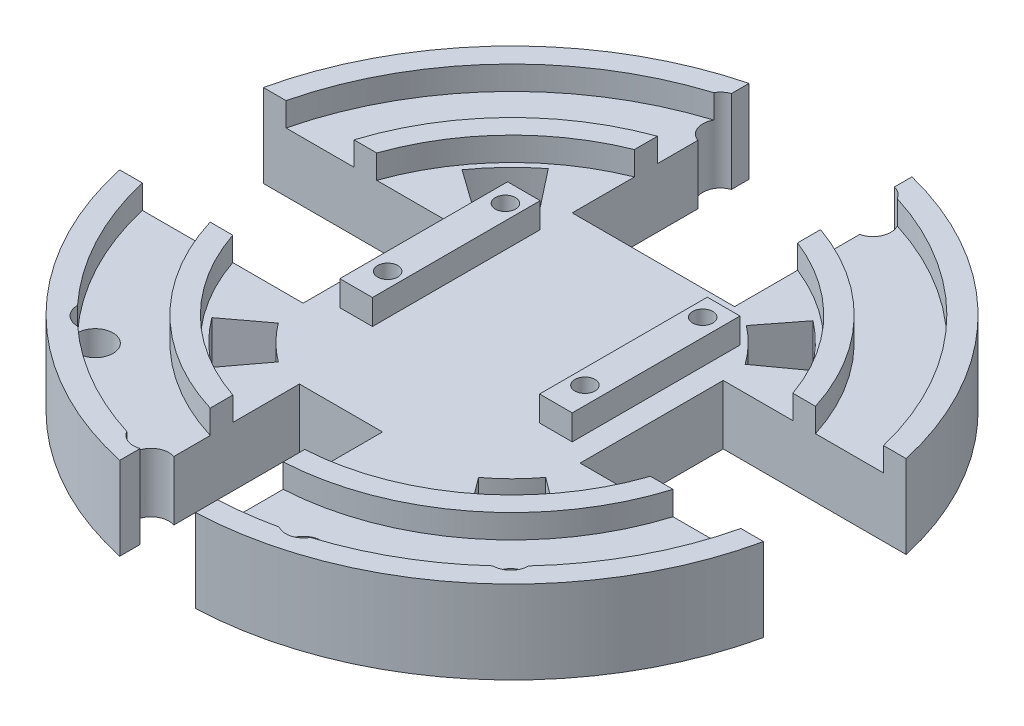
SolidWorks part; units mm, degrees
ref_plane "Front Plane" through (0, 0, 0) normal (0, 0, 1) x (1, 0, 0)
ref_plane "Top Plane" through (0, 0, 0) normal (0, 1, 0) x (1, 0, 0)
ref_plane "Right Plane" through (0, 0, 0) normal (1, 0, 0) x (0, 0, -1)
sketch "Sketch1" plane through (0, 0, 0) normal (0, 1, 0) x (1, 0, 0)
  line L0 (16.1798, 0) -> (16.1798, -20.0078)
  line L1 (0, 0) -> (29.6291, 0) construction
  line L2 (0, 0) -> (0, 5.0439) construction
  line L3 (0, 30.4419) -> (29.6291, 30.4419) construction
  line L4 (29.6291, 0) -> (29.6291, 5.0439) construction
  line L5 (8.5598, -0.1778) -> (8.5598, 0) construction
  line L6 (29.8069, 7.9375) -> (29.6291, 7.9375) construction
  line L7 (22.1297, 30.6197) -> (22.1297, 30.4419) construction
  line L8 (29.6291, 22.9997) -> (31.1531, 22.9997)
  line L9 (31.1531, 22.9997) -> (29.6291, 25.6393) construction
  line L10 (29.6291, 7.6835) -> (31.1531, 7.6835)
  line L11 (31.1531, 7.6835) -> (29.6291, 5.0439) construction
  line L12 (0, 5.0439) -> (-1.524, 7.6835) construction
  line L13 (-1.524, 7.6835) -> (0, 7.6835)
  line L14 (0, 22.9997) -> (-1.524, 22.9997)
  line L15 (-1.524, 22.9997) -> (0, 25.6393) construction
  line L16 (0, 25.6393) -> (0, 30.4419) construction
  line L17 (0, 7.6835) -> (0, 22.9997)
  line L18 (29.6291, 7.6835) -> (29.6291, 22.9997)
  line L19 (29.6291, 25.6393) -> (29.6291, 30.4419) construction
  line L20 (0, 22.9997) -> (0, 25.6393) construction
  line L21 (0, 5.0439) -> (0, 7.6835) construction
  line L22 (29.6291, 5.0439) -> (29.6291, 7.6835) construction
  line L23 (29.6291, 22.9997) -> (29.6291, 25.6393) construction
  line L24 (-1.524, 7.6835) -> (-1.524, 7.9375) construction
  line L25 (-1.524, 7.9375) -> (-0.1778, 7.9375) construction
  line L26 (31.1531, 7.6835) -> (31.1531, 7.9375) construction
  line L27 (29.8069, 7.9375) -> (31.1531, 7.9375) construction
  line L28 (31.1531, 22.9997) -> (31.1531, 22.7457) construction
  line L29 (31.1531, 22.7457) -> (29.8069, 22.7457) construction
  line L30 (-1.524, 22.7457) -> (-1.524, 22.9997) construction
  line L31 (-0.1778, 22.7457) -> (-1.524, 22.7457) construction
  line L32 (7.2898, 0) -> (7.2898, -19.2219)
  line L33 (-1.524, 7.6835) -> (-19.6255, 7.6835)
  line L34 (7.2898, 0) -> (16.1798, 0)
  line L35 (31.1531, 7.6835) -> (49.2546, 7.6835)
  line L36 (-1.524, 22.9997) -> (-19.5718, 22.9997)
  line L37 (6.0261, 30.4419) -> (6.0261, 49.3632)
  line L38 (23.3997, 30.4419) -> (23.3997, 49.4149)
  line L39 (31.1531, 22.9997) -> (49.2009, 22.9997)
  line L40 (6.0261, 30.4419) -> (23.3997, 30.4419)
  line L41 (6.0261, 31.8897) -> (7.2961, 31.8897) construction
  line L42 (22.1297, 31.8897) -> (23.3997, 31.8897) construction
  line L43 (8.5598, -1.4478) -> (7.2898, -1.4478) construction
  line L44 (8.5598, -0.1778) -> (8.5598, -1.4478) construction
  line L45 (8.5598, -1.4478) -> (14.9098, -1.4478) construction
  line L46 (14.9098, -1.4478) -> (16.1798, -1.4478) construction
  arc A0 (7.2898, -19.2219) -> (-19.6255, 7.6835) centre (14.8145, 15.2209) cw
  circle A1 centre (14.8145, 15.2209) radius 32.7152 construction
  circle A2 centre (14.8145, 15.2209) radius 32.7152 construction
  arc A3 (16.1798, -20.0078) -> (49.2546, 7.6835) centre (14.8145, 15.2209) ccw
  arc A4 (-19.5718, 22.9997) -> (6.0261, 49.3632) centre (14.8145, 15.2209) cw
  arc A5 (23.3997, 49.4149) -> (49.2009, 22.9997) centre (14.8145, 15.2209) cw
  point P73 (7.0142, 33.4093)
  point P74 (3.2844, 30.4419)
  point P75 (4.7389, 34.7287)
  point P76 (3.1281, 31.8897)
  point P77 (4.3917, 31.8897)
  point P78 (5.3912, 32.0959)
  point P79 (-17.0497, 7.6835)
  point P80 (7.2898, -23.7407)
  dimension "D4" = 2.54
  dimension "D1" = 60
  dimension "D2" = 0.254
  dimension "D3" = 1.27
extrude "Boss-Extrude1" add sketch "Sketch1" along normal up to surface (6.35 mm away)
sketch "Sketch2" plane through (0, 6.35, 0) normal (0, 1, 0) x (1, 0, 0)
  line L0 (5.0102, 9.0488) -> (24.6189, 9.0488) construction
  line L1 (5.0102, 9.0488) -> (24.6189, 9.0488) construction
  line L2 (27.2478, 9.2266) -> (23.7553, 9.2266)
  line L3 (41.2085, -50.0815) -> (43.3675, -50.0815) construction
  line L4 (2.3812, 27.1717) -> (2.3812, 3.2703)
  line L5 (2.3812, 3.2703) -> (27.2478, 3.2703)
  line L6 (27.2478, 3.2703) -> (27.2478, 27.1717)
  line L7 (27.2478, 27.1717) -> (2.3812, 27.1717)
  line L8 (2.3812, 27.1717) -> (2.3812, 9.2266)
  line L9 (6.0515, 13.7859) -> (6.0515, 25.4699) construction
  line L10 (27.2478, 9.2266) -> (27.2478, 27.1717)
  line L11 (27.2478, 27.1717) -> (23.7553, 27.1717)
  line L12 (14.8146, 27.1717) -> (14.8146, 9.0488) construction
  line L13 (6.0515, 13.7859) -> (6.0515, 25.4699) construction
  line L14 (5.8737, 9.2266) -> (5.8737, 27.1717)
  line L15 (23.7553, 9.2266) -> (23.7553, 27.1717)
  line L16 (5.8737, 9.2266) -> (2.3812, 9.2266)
  line L17 (5.8737, 27.1717) -> (2.3812, 27.1717)
  line L18 (5.8737, 27.1717) -> (23.7553, 27.1717) construction
  line L19 (41.2085, -50.0815) -> (43.3675, -50.0815) construction
  line L20 (3.1814, 25.0634) -> (5.3403, 25.0634) construction
  circle A0 centre (4.2608, 25.0634) radius 1.0922 construction
  circle A1 centre (4.2608, 25.0634) radius 1.0922 construction
  circle A2 centre (4.2608, 12.465) radius 1.0922 construction
  circle A3 centre (25.3682, 12.465) radius 1.0922 construction
  circle A4 centre (25.3682, 25.0634) radius 1.0922 construction
  circle A5 centre (4.2608, 25.0634) radius 1.0922 construction
  circle A6 centre (4.2608, 12.465) radius 1.0922 construction
  circle A7 centre (25.3682, 12.465) radius 1.0922 construction
  circle A8 centre (25.3682, 25.0634) radius 1.0922 construction
  circle A9 centre (4.2608, 25.0634) radius 1.0795
  circle A10 centre (25.3682, 25.0634) radius 1.0795
  circle A11 centre (25.3682, 12.465) radius 1.0795
  circle A12 centre (4.2608, 12.465) radius 1.0795
  point P17 (5.353, 25.0634)
  dimension "D2" = 0.1778
  dimension "D3" = 0.1778
  dimension "D1" = 0
extrude "Boss-Extrude2" add sketch "Sketch2" along normal up to surface (2.6924 mm away)
sketch "Sketch3" plane through (0, 6.35, 0) normal (0, 1, 0) x (1, 0, 0)
  circle A0 centre (25.3682, 25.0634) radius 1.0795 construction
  circle A1 centre (25.3682, 12.465) radius 1.0922 construction
  circle A2 centre (4.2608, 12.465) radius 1.0922 construction
  circle A3 centre (4.2608, 25.0634) radius 1.0795 construction
  circle A4 centre (25.3682, 25.0634) radius 1.0795
  circle A5 centre (25.3682, 12.465) radius 1.0922
  circle A6 centre (4.2608, 12.465) radius 1.0922
  circle A7 centre (4.2608, 25.0634) radius 1.0795
extrude "Cut-Extrude1" cut sketch "Sketch3" against normal through all
sketch "Sketch5" plane through (0, 6.35, 0) normal (0, 1, 0) x (1, 0, 0)
  line L0 (-19.5718, 22.9997) -> (-17.1454, 22.9997)
  line L1 (-19.5718, 22.9997) -> (0, 22.9997) construction
  line L2 (6.0261, 30.4419) -> (6.0261, 49.3632) construction
  line L3 (6.0261, 46.9182) -> (6.0261, 49.3632)
  line L4 (6.0261, 37.1017) -> (6.0261, 39.5658)
  line L5 (-7.4451, 22.9997) -> (-9.8715, 22.9997)
  line L6 (0, 7.6835) -> (-19.6255, 7.6835) construction
  line L7 (7.2898, -19.2219) -> (7.2898, 0) construction
  line L8 (16.1798, 0) -> (16.1798, -20.0078) construction
  line L9 (49.2546, 7.6835) -> (29.6291, 7.6835) construction
  line L10 (29.6291, 22.9997) -> (49.2009, 22.9997) construction
  line L11 (23.3997, 49.4149) -> (23.3997, 30.4419) construction
  line L12 (23.3997, 39.6382) -> (23.3997, 37.1822)
  line L13 (37.0742, 22.9997) -> (39.5006, 22.9997)
  line L14 (39.5753, 7.6835) -> (37.1571, 7.6835)
  line L15 (16.1798, -10.6256) -> (16.1798, -8.3192)
  line L16 (7.2898, -9.5437) -> (7.2898, -7.1259)
  line L17 (-7.528, 7.6835) -> (-9.9462, 7.6835)
  line L18 (-19.6255, 7.6835) -> (-17.2032, 7.6835)
  line L19 (7.2898, -16.7998) -> (7.2898, -19.2219)
  line L20 (16.1798, -20.0078) -> (16.1798, -17.6437)
  line L21 (46.8323, 7.6835) -> (49.2546, 7.6835)
  line L22 (46.7745, 22.9997) -> (49.2009, 22.9997)
  line L23 (23.3997, 46.9738) -> (23.3997, 49.4149)
  arc A0 (49.2009, 22.9997) -> (23.3997, 49.4149) centre (14.8145, 15.2209) ccw construction
  arc A1 (16.1798, -20.0078) -> (49.2546, 7.6835) centre (14.8145, 15.2209) ccw construction
  arc A2 (-19.6255, 7.6835) -> (7.2898, -19.2219) centre (14.8145, 15.2209) ccw construction
  arc A3 (6.0261, 49.3632) -> (-19.5718, 22.9997) centre (14.8145, 15.2209) ccw construction
  arc A4 (49.2009, 22.9997) -> (23.3997, 49.4149) centre (14.8145, 15.2209) ccw
  arc A5 (16.1798, -20.0078) -> (49.2546, 7.6835) centre (14.8145, 15.2209) ccw
  arc A6 (-19.6255, 7.6835) -> (7.2898, -19.2219) centre (14.8145, 15.2209) ccw
  arc A7 (6.0261, 49.3632) -> (-19.5718, 22.9997) centre (14.8145, 15.2209) ccw
  arc A8 (-17.1454, 22.9997) -> (6.0261, 46.9182) centre (14.8145, 15.2209) cw
  circle A9 centre (14.8145, 15.2209) radius 32.7152 construction
  arc A10 (-9.8715, 22.9997) -> (6.0261, 39.5658) centre (14.8145, 15.2209) cw
  arc A11 (6.0261, 37.1017) -> (-7.4451, 22.9997) centre (14.8146, 15.2209) ccw
  circle A12 centre (14.8145, 15.2209) radius 26.0604 construction
  arc A13 (-17.2032, 7.6835) -> (7.2898, -16.7998) centre (14.8145, 15.2209) ccw
  arc A14 (16.1798, -17.6437) -> (46.8323, 7.6835) centre (14.8145, 15.2209) ccw
  arc A15 (46.7745, 22.9997) -> (23.3997, 46.9738) centre (14.8145, 15.2209) ccw
  arc A16 (16.1798, -10.6256) -> (39.5753, 7.6835) centre (14.8145, 15.2209) ccw
  arc A17 (23.3997, 37.1822) -> (37.0742, 22.9997) centre (14.8145, 15.2209) cw
  arc A18 (39.5006, 22.9997) -> (23.3997, 39.6382) centre (14.8145, 15.2209) ccw
  arc A19 (16.1798, -8.3192) -> (37.1571, 7.6835) centre (14.8145, 15.2209) ccw
  arc A20 (7.2898, -9.5437) -> (-9.9462, 7.6835) centre (14.8145, 15.2209) cw
  arc A21 (-7.528, 7.6835) -> (7.2898, -7.1259) centre (14.8145, 15.2209) ccw
  dimension "D1" = 0.1778
  dimension "D2" = 0.1778
extrude "Boss-Extrude3" add sketch "Sketch5" along normal blind 2.54
sketch "Sketch6" plane through (0, 6.35, 0) normal (0, 1, 0) x (1, 0, 0)
  line L0 (-3.8614, 28.5501) -> (0.2735, 25.599)
  line L1 (0.6454, 33.268) -> (3.7825, 29.2723)
  line L2 (28.8999, 33.3334) -> (25.7814, 29.3233)
  line L3 (29.3074, 25.6663) -> (33.4286, 28.6365)
  line L4 (29.1176, 4.5172) -> (33.1848, 1.4734)
  line L5 (28.5725, -3.1414) -> (25.5265, 0.924)
  line L6 (4.1108, 0.9179) -> (1.067, -3.1493)
  line L7 (0.5176, 4.509) -> (-3.5478, 1.463)
  line L8 (14.8146, 15.2209) -> (31.7892, 31.5875) construction
  line L9 (14.8146, 15.2209) -> (-1.8541, -1.4572) construction
  line L10 (14.8146, 15.2209) -> (31.5556, -1.5106) construction
  line L12 (14.8146, 15.2209) -> (-2.2357, 31.5087) construction
  arc A0 (-3.8614, 28.5501) -> (0.6454, 33.268) centre (14.8146, 15.2209) cw
  arc A1 (0.2735, 25.599) -> (3.7825, 29.2723) centre (14.8146, 15.2209) cw
  arc A2 (0.5176, 4.509) -> (4.1108, 0.9179) centre (14.8146, 15.2209) ccw
  arc A3 (-3.5478, 1.463) -> (1.067, -3.1493) centre (14.8146, 15.2209) ccw
  arc A4 (6.0261, 37.1017) -> (-7.4451, 22.9997) centre (14.8146, 15.2209) ccw construction
  arc A5 (28.5725, -3.1414) -> (33.1848, 1.4734) centre (14.8146, 15.2209) ccw
  arc A6 (25.5265, 0.924) -> (29.1176, 4.5172) centre (14.8146, 15.2209) ccw
  arc A7 (29.3074, 25.6663) -> (25.7814, 29.3233) centre (14.8146, 15.2209) ccw
  arc A8 (28.8999, 33.3334) -> (33.4286, 28.6365) centre (14.8146, 15.2209) cw
  arc A9 (37.0742, 22.9997) -> (23.3997, 37.1822) centre (14.8145, 15.2209) ccw construction
  arc A10 (-7.528, 7.6835) -> (7.2898, -7.1259) centre (14.8145, 15.2209) ccw construction
  arc A11 (-7.528, 7.6835) -> (7.2898, -7.1259) centre (14.8145, 15.2209) ccw construction
  point P26 (31.332, 31.1468)
  point P29 (27.4504, 2.5923)
  point P30 (-2.2357, 31.5087)
  point P31 (-1.7766, 31.07)
  point P42 (-1.8541, -1.4572)
  point P43 (2.1859, 2.5851)
  dimension "D1" = 0.635
  dimension "D3" = 5.08
  dimension "D2" = 5.08
  dimension "D4" = 5.08
  dimension "D5" = 5.08
extrude "Cut-Extrude3" cut sketch "Sketch6" against normal through all
sketch "Sketch7" plane through (0, 6.35, 0) normal (0, 1, 0) x (1, 0, 0)
  circle A0 centre (6.6611, 45.6828) radius 1.905
  circle A1 centre (22.968, 45.6828) radius 1.905
  circle A2 centre (-7.4168, -7.1435) radius 1.905
  circle A3 centre (6.6611, -15.2409) radius 1.905
  circle A4 centre (22.9679, -15.2409) radius 1.905
  circle A5 centre (37.0459, -7.1435) radius 1.905
  circle A6 centre (22.968, 45.6828) radius 0.4699 construction
  circle A7 centre (6.6611, 45.6828) radius 0.4699 construction
  point P16 (0, 0)
  dimension "D1" = 3.81
extrude "Cut-Extrude4" cut sketch "Sketch7" against normal through all both and the other way through all
